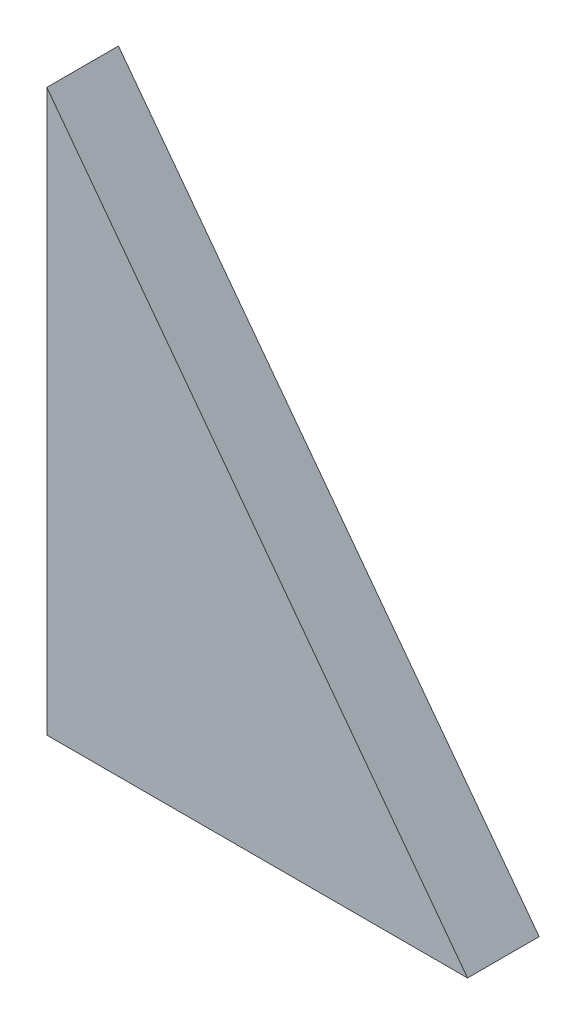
SolidWorks part; units mm, degrees
ref_plane "Front Plane" through (0, 0, 0) normal (0, 0, 1) x (1, 0, 0)
ref_plane "Top Plane" through (0, 0, 0) normal (0, 1, 0) x (1, 0, 0)
ref_plane "Right Plane" through (0, 0, 0) normal (1, 0, 0) x (0, 0, -1)
sketch "Sketch2" plane through (0, 0, 0) normal (0, 0, 1) x (1, 0, 0)
  line L0 (0, 99.4737) -> (0, 0)
  line L1 (74.5999, 0) -> (0, 0)
  line L2 (74.5999, 0) -> (0, 99.4737)
  dimension "D1" = 74.5999
  dimension "D2" = 99.4737
extrude "Boss-Extrude2" add sketch "Sketch2" along normal blind 12.7
